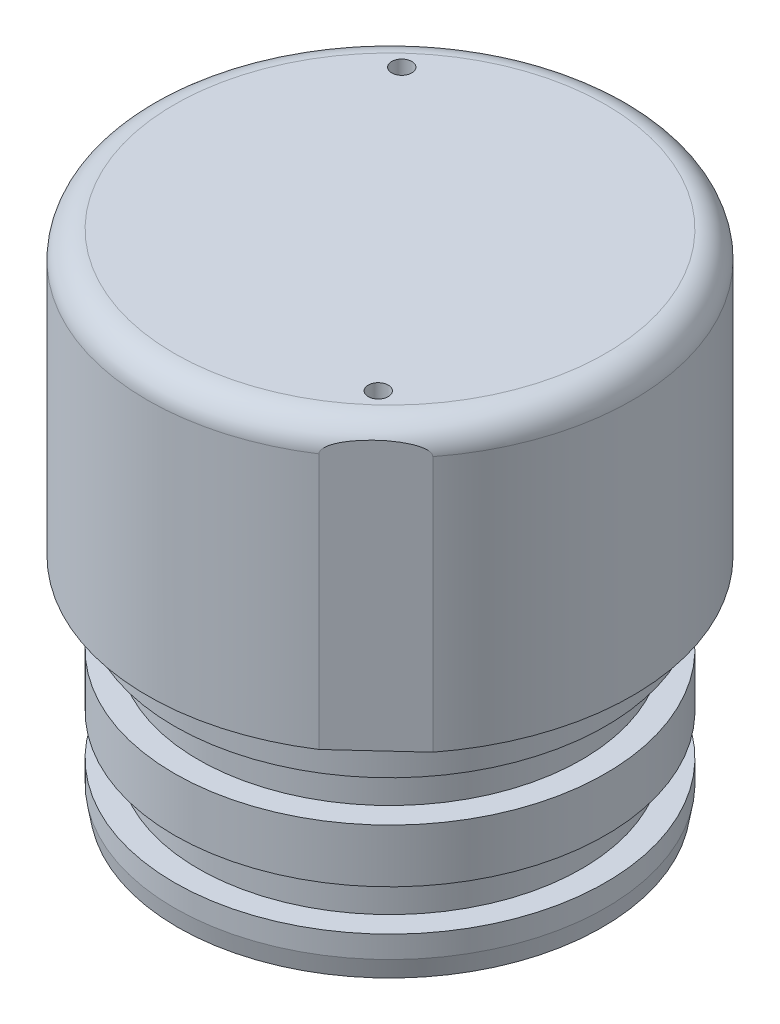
SolidWorks part; units mm, degrees
ref_plane "Front Plane" through (0, 0, 0) normal (0, 0, 1) x (1, 0, 0)
ref_plane "Top Plane" through (0, 0, 0) normal (0, 1, 0) x (1, 0, 0)
ref_plane "Right Plane" through (0, 0, 0) normal (1, 0, 0) x (0, 0, -1)
sketch "Sketch1" plane through (0, 0, 0) normal (0, 1, 0) x (1, 0, 0)
  circle A0 centre (0, 0) radius 25.4
  dimension "D1" = 50.8
extrude "Boss-Extrude1" add sketch "Sketch1" against normal blind 25.4
sketch "Sketch2" plane through (0, 0, 0) normal (0, 1, 0) x (1, 0, 0)
  circle A0 centre (0, 0) radius 28.575
  dimension "D1" = 57.15
extrude "Boss-Extrude2" add sketch "Sketch2" along normal blind 33.3248
sketch "Sketch6" plane through (0, -25.4, 0) normal (0, -1, 0) x (1, 0, 0)
  circle A0 centre (0, 0) radius 19.05
  dimension "D1" = 38.1
extrude "Cut-Extrude3" cut sketch "Sketch6" against normal blind 50.8
sketch "Sketch7" plane through (0, -25.4, 0) normal (0, -1, 0) x (1, 0, 0)
  circle A0 centre (0, 0) radius 22.5806
  dimension "D1" = 45.1612
extrude "Cut-Extrude4" cut sketch "Sketch7" against normal blind 4.826 from offset 4.7498 flip side to cut
sketch "Sketch8" plane through (0, -25.4, 0) normal (0, -1, 0) x (1, 0, 0)
  circle A0 centre (0, 0) radius 22.5806
  dimension "D1" = 45.1612
extrude "Cut-Extrude6" cut sketch "Sketch8" against normal blind 4.826 from offset 15.875 flip side to cut
chamfer "Chamfer1" distance 0.381 angle 80 1 edges at (0, -25.4, 25.4)
sketch "Sketch9" plane through (0, 0, 0) normal (0, 0, 1) x (1, 0, 0)
  line L0 (28.575, 33.3248) -> (-28.575, 33.3248) construction
  circle A0 centre (0, 19.05) radius 11.1125
  dimension "D1" = 22.225
  dimension "D2" = 14.2748
extrude "Cut-Extrude7" cut sketch "Sketch9" against normal through all
fillet "Fillet1" radius 3.175 1 edges at (0, 33.3248, 28.575)
sketch "Sketch10" plane through (0, 33.3248, 0) normal (0, 1, 0) x (1, 0, 0)
  line L0 (0, 0) -> (0, 28.575) construction
  line L1 (0, 0) -> (19.3417, -21.034) construction
  line L2 (22.5666, -17.5294) -> (15.5796, -23.9542)
  arc A0 (-0.5311, 28.5701) -> (0.5311, 28.5701) centre (0, 0) ccw construction
  parabola Q0 construction
  dimension "D1" = 4.7625
  dimension "D2" = 137.4
extrude "Cut-Extrude8" cut sketch "Sketch10" against normal through all and the other way through all
pattern_circular "CirPattern1" count 2 over 360 about axis through (0, 33.3248, 0) along (0, -1, 0) of "Cut-Extrude8"
sketch "Sketch11" plane through (0, 33.3248, 0) normal (0, 1, 0) x (1, 0, 0)
  line L0 (-19.0731, 20.7418) -> (19.0731, -20.7418) construction
  line L1 (-15.5796, 23.9542) -> (-22.5666, 17.5294) construction
  line L2 (15.5796, -23.9542) -> (22.5666, -17.5294) construction
  circle A0 centre (-15.8172, 17.2011) radius 1.1811
  circle A1 centre (15.8172, -17.2011) radius 1.1811
  dimension "D1" = 2.3622
  dimension "D2" = 2.3622
  dimension "D3" = 23.368
  dimension "D4" = 23.368
extrude "Cut-Extrude9" cut sketch "Sketch11" against normal blind 9.525
hole_wizard "#4-40 Tapped Hole1" positions "Sketch12" profile "Sketch13" tap size "#4-40" standard "ANSI Inch"
sketch "Sketch12" plane through (0, -25.4, 0) normal (0, -1, 0) x (-1, 0, 0)
  point P0 (14.5624, 15.9394)
  point P9 (15.9394, -14.5624)
  point P10 (-14.5624, -15.9394)
  point P11 (-15.9394, 14.5624)
  point P14 (14.6361, 16.02)
  dimension "D1" = 21.59
  dimension "D2" = 4
sketch "Sketch13" plane through (-14.5624, -25.4, -15.9394) normal (1, 0, 0) x (0, 0, -1)
  line L0 (0, 0) -> (0, 3.8542)
  line L1 (0, 3.8542) -> (1.1303, 3.175)
  line L2 (1.1303, 3.175) -> (1.1303, 0)
  line L5 (1.1303, 0) -> (0, 0)
  line L10 (0, 3.8542) -> (-1.1303, 3.175) construction
  line L11 (0, -6.35) -> (0, 107.95) construction
  dimension "Tap Drill Dia." = 2.2606
  dimension "Tap Drill Depth" = 3.175
  dimension "Drill Angle" = 118
